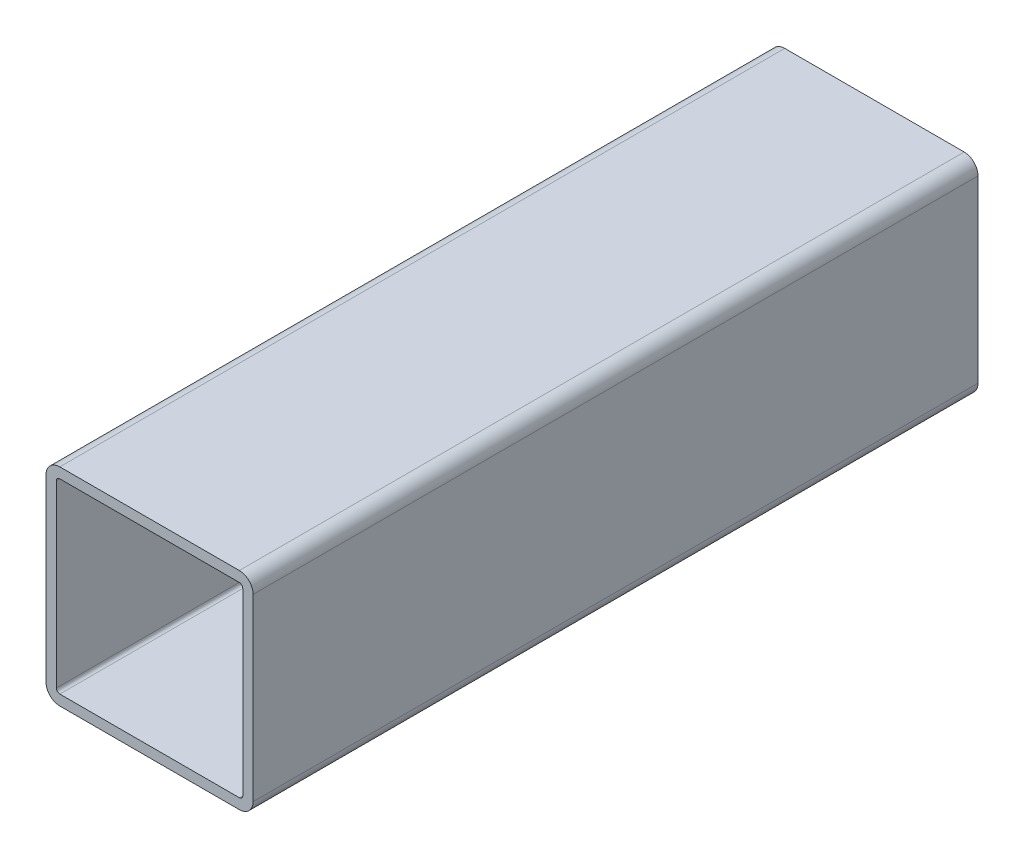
SolidWorks part; units mm, degrees
ref_plane "Face" through (0, 0, 0) normal (0, 0, 1) x (1, 0, 0)
ref_plane "Dessus" through (0, 0, 0) normal (0, 1, 0) x (1, 0, 0)
ref_plane "Droite" through (0, 0, 0) normal (1, 0, 0) x (0, 0, -1)
sketch "Esquisse1" plane through (0, 0, 0) normal (0, 0, 1) x (1, 0, 0)
  line L0 (3, -4) -> (3, -56)
  line L1 (4, 0) -> (56, 0)
  line L2 (0, -4) -> (0, -56)
  line L3 (4, -60) -> (56, -60)
  line L4 (60, -4) -> (60, -56)
  line L5 (4, -57) -> (56, -57)
  line L6 (57, -4) -> (57, -56)
  line L7 (4, -3) -> (56, -3)
  arc A0 (60, -56) -> (56, -60) centre (56, -56) cw
  arc A1 (56, 0) -> (60, -4) centre (56, -4) cw
  arc A2 (0, -4) -> (4, 0) centre (4, -4) cw
  arc A3 (4, -60) -> (0, -56) centre (4, -56) cw
  arc A4 (4, -57) -> (3, -56) centre (4, -56) cw
  arc A5 (57, -56) -> (56, -57) centre (56, -56) cw
  arc A6 (56, -3) -> (57, -4) centre (56, -4) cw
  arc A7 (3, -4) -> (4, -3) centre (4, -4) cw
  point P9 (60, 0)
  point P12 (0, 0)
  point P15 (0, -60)
  dimension "D3" = 4
  dimension "D1" = 60
  dimension "D2" = 60
  dimension "D4" = 3
extrude "Base-Extrusion" add sketch "Esquisse1" along normal blind 210
